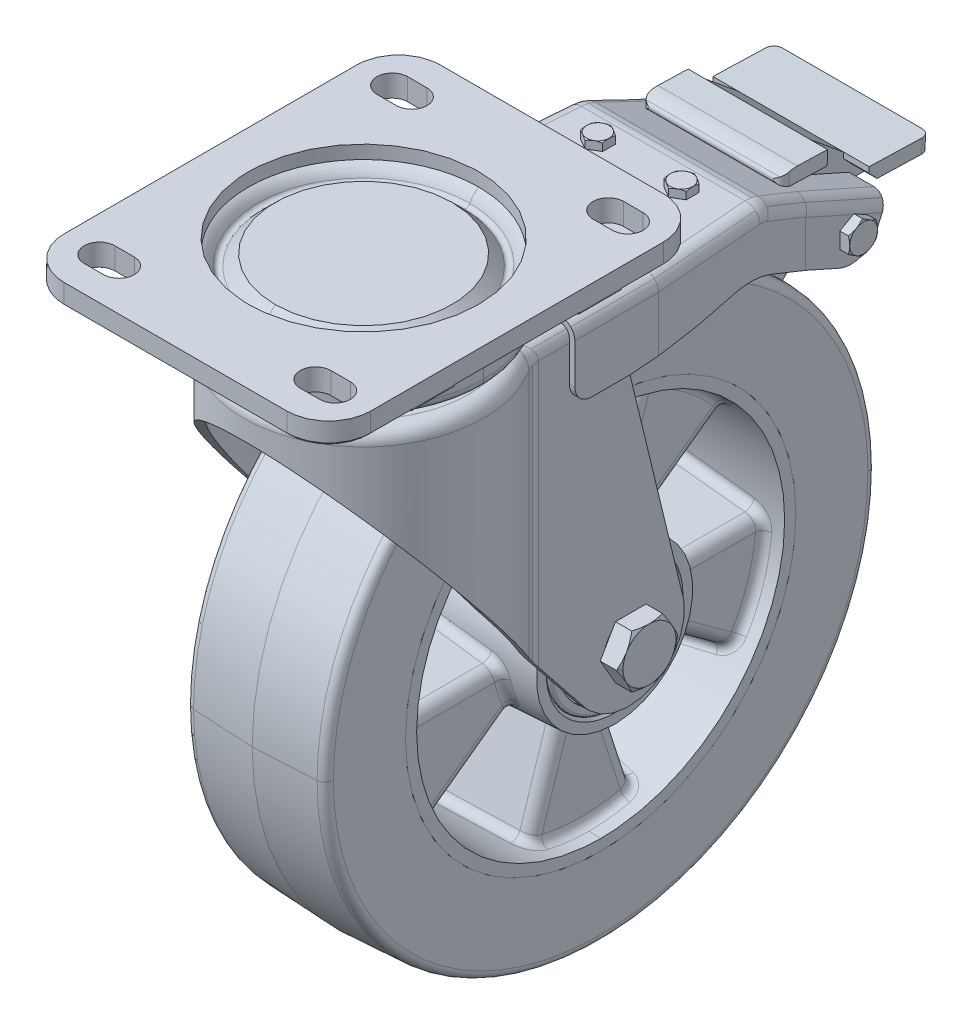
SolidWorks part; units mm, degrees
ref_plane "Front Plane" through (0, 0, 0) normal (0, 0, 1) x (1, 0, 0)
ref_plane "Top Plane" through (0, 0, 0) normal (0, 1, 0) x (1, 0, 0)
ref_plane "Right Plane" through (0, 0, 0) normal (1, 0, 0) x (0, 0, -1)
imported_body "1.5031 Pyörä D200 H238 kääntyvä lukollinen kuulalaakerilla.STEP<1>"
ref_plane "Plane1" through (0, 235.5477, 0) normal (0, 1, 0) x (1, 0, 0)
sketch "Sketch4" plane through (0, 235.5477, 0) normal (0, 1, 0) x (1, 0, 0)
  line L0 (91.5755, -133.1883) -> (11.5755, -133.1883) construction
  line L1 (106.5755, -253.1883) -> (106.5755, -148.1883) construction
  line L2 (11.5755, -268.1883) -> (91.5755, -268.1883) construction
  line L3 (-3.4245, -148.1883) -> (-3.4245, -253.1883) construction
  line L4 (91.5755, -133.1883) -> (11.5755, -133.1883)
  line L5 (106.5755, -253.1883) -> (106.5755, -148.1883)
  line L6 (11.5755, -268.1883) -> (91.5755, -268.1883)
  line L7 (-3.4245, -148.1883) -> (-3.4245, -253.1883)
  arc A0 (0.9689, -137.5817) -> (-3.4245, -148.1883) centre (11.5755, -148.1883) ccw construction
  arc A1 (11.5755, -133.1883) -> (0.9689, -137.5817) centre (11.5755, -148.1883) ccw construction
  arc A2 (102.1821, -137.5817) -> (91.5755, -133.1883) centre (91.5755, -148.1883) ccw construction
  arc A3 (106.5755, -148.1883) -> (102.1821, -137.5817) centre (91.5755, -148.1883) ccw construction
  arc A4 (102.1821, -263.7949) -> (106.5755, -253.1883) centre (91.5755, -253.1883) ccw construction
  arc A5 (91.5755, -268.1883) -> (102.1821, -263.7949) centre (91.5755, -253.1883) ccw construction
  arc A6 (0.9689, -263.7949) -> (11.5755, -268.1883) centre (11.5755, -253.1883) ccw construction
  arc A7 (-3.4245, -253.1883) -> (0.9689, -263.7949) centre (11.5755, -253.1883) ccw construction
  arc A8 (0.9689, -137.5817) -> (-3.4245, -148.1883) centre (11.5755, -148.1883) ccw
  arc A9 (11.5755, -133.1883) -> (0.9689, -137.5817) centre (11.5755, -148.1883) ccw
  arc A10 (102.1821, -137.5817) -> (91.5755, -133.1883) centre (91.5755, -148.1883) ccw
  arc A11 (106.5755, -148.1883) -> (102.1821, -137.5817) centre (91.5755, -148.1883) ccw
  arc A12 (102.1821, -263.7949) -> (106.5755, -253.1883) centre (91.5755, -253.1883) ccw
  arc A13 (91.5755, -268.1883) -> (102.1821, -263.7949) centre (91.5755, -253.1883) ccw
  arc A14 (0.9689, -263.7949) -> (11.5755, -268.1883) centre (11.5755, -253.1883) ccw
  arc A15 (-3.4245, -253.1883) -> (0.9689, -263.7949) centre (11.5755, -253.1883) ccw
extrude "Cut-Extrude1" cut sketch "Sketch4" along normal through all
sketch "Sketch5" plane through (0, 235.5477, 0) normal (0, 1, 0) x (1, 0, 0)
  line L0 (93.8255, -258.6883) -> (86.8255, -258.6883) construction
  line L1 (86.8255, -247.6883) -> (93.8255, -247.6883) construction
  line L2 (16.3255, -258.6883) -> (9.3255, -258.6883) construction
  line L3 (9.3255, -247.6883) -> (16.3255, -247.6883) construction
  line L4 (-3.4245, -148.1883) -> (-3.4245, -253.1883)
  line L6 (-3.4245, -148.1883) -> (-3.4245, -253.1883)
  line L12 (86.8255, -142.6883) -> (93.8255, -142.6883) construction
  line L13 (93.8255, -153.6883) -> (86.8255, -153.6883) construction
  line L14 (9.3255, -142.6883) -> (16.3255, -142.6883) construction
  line L15 (16.3255, -153.6883) -> (9.3255, -153.6883) construction
  line L16 (93.8255, -258.6883) -> (86.8255, -258.6883)
  line L17 (86.8255, -247.6883) -> (93.8255, -247.6883)
  line L18 (16.3255, -258.6883) -> (9.3255, -258.6883)
  line L19 (9.3255, -247.6883) -> (16.3255, -247.6883)
  line L20 (86.8255, -142.6883) -> (93.8255, -142.6883)
  line L21 (93.8255, -153.6883) -> (86.8255, -153.6883)
  line L22 (9.3255, -142.6883) -> (16.3255, -142.6883)
  line L23 (16.3255, -153.6883) -> (9.3255, -153.6883)
  line L28 (11.5755, -268.1883) -> (91.5755, -268.1883)
  line L29 (11.5755, -268.1883) -> (91.5755, -268.1883)
  line L30 (106.5755, -253.1883) -> (106.5755, -148.1883)
  line L31 (106.5755, -253.1883) -> (106.5755, -148.1883)
  line L32 (91.5755, -133.1883) -> (11.5755, -133.1883)
  line L33 (91.5755, -133.1883) -> (11.5755, -133.1883)
  arc A0 (51.5755, -241.9466) -> (51.5755, -159.4299) centre (51.5755, -200.6883) ccw construction
  arc A1 (51.5755, -159.4299) -> (51.5755, -241.9466) centre (51.5755, -200.6883) ccw construction
  arc A2 (51.5755, -241.9466) -> (51.5755, -159.4299) centre (51.5755, -200.6883) ccw
  arc A3 (51.5755, -159.4299) -> (51.5755, -241.9466) centre (51.5755, -200.6883) ccw
  arc A4 (93.8255, -258.6883) -> (93.8255, -247.6883) centre (93.8255, -253.1883) ccw construction
  arc A5 (86.8255, -247.6883) -> (86.8255, -258.6883) centre (86.8255, -253.1883) ccw construction
  arc A6 (16.3255, -258.6883) -> (16.3255, -247.6883) centre (16.3255, -253.1883) ccw construction
  arc A7 (9.3255, -247.6883) -> (9.3255, -258.6883) centre (9.3255, -253.1883) ccw construction
  arc A8 (11.5755, -133.1883) -> (0.9689, -137.5817) centre (11.5755, -148.1883) ccw
  arc A10 (11.5755, -133.1883) -> (0.9689, -137.5817) centre (11.5755, -148.1883) ccw
  arc A24 (93.8255, -153.6883) -> (93.8255, -142.6883) centre (93.8255, -148.1883) ccw construction
  arc A25 (86.8255, -142.6883) -> (86.8255, -153.6883) centre (86.8255, -148.1883) ccw construction
  arc A26 (16.3255, -153.6883) -> (16.3255, -142.6883) centre (16.3255, -148.1883) ccw construction
  arc A27 (9.3255, -142.6883) -> (9.3255, -153.6883) centre (9.3255, -148.1883) ccw construction
  arc A28 (93.8255, -258.6883) -> (93.8255, -247.6883) centre (93.8255, -253.1883) ccw
  arc A29 (86.8255, -247.6883) -> (86.8255, -258.6883) centre (86.8255, -253.1883) ccw
  arc A30 (16.3255, -258.6883) -> (16.3255, -247.6883) centre (16.3255, -253.1883) ccw
  arc A31 (9.3255, -247.6883) -> (9.3255, -258.6883) centre (9.3255, -253.1883) ccw
  arc A32 (93.8255, -153.6883) -> (93.8255, -142.6883) centre (93.8255, -148.1883) ccw
  arc A33 (86.8255, -142.6883) -> (86.8255, -153.6883) centre (86.8255, -148.1883) ccw
  arc A34 (16.3255, -153.6883) -> (16.3255, -142.6883) centre (16.3255, -148.1883) ccw
  arc A35 (9.3255, -142.6883) -> (9.3255, -153.6883) centre (9.3255, -148.1883) ccw
  arc A40 (0.9689, -137.5817) -> (-3.4245, -148.1883) centre (11.5755, -148.1883) ccw
  arc A41 (0.9689, -137.5817) -> (-3.4245, -148.1883) centre (11.5755, -148.1883) ccw
  arc A42 (-3.4245, -253.1883) -> (0.9689, -263.7949) centre (11.5755, -253.1883) ccw
  arc A43 (-3.4245, -253.1883) -> (0.9689, -263.7949) centre (11.5755, -253.1883) ccw
  arc A44 (0.9689, -263.7949) -> (11.5755, -268.1883) centre (11.5755, -253.1883) ccw
  arc A45 (0.9689, -263.7949) -> (11.5755, -268.1883) centre (11.5755, -253.1883) ccw
  arc A46 (91.5755, -268.1883) -> (102.1821, -263.7949) centre (91.5755, -253.1883) ccw
  arc A47 (91.5755, -268.1883) -> (102.1821, -263.7949) centre (91.5755, -253.1883) ccw
  arc A48 (102.1821, -263.7949) -> (106.5755, -253.1883) centre (91.5755, -253.1883) ccw
  arc A49 (102.1821, -263.7949) -> (106.5755, -253.1883) centre (91.5755, -253.1883) ccw
  arc A50 (106.5755, -148.1883) -> (102.1821, -137.5817) centre (91.5755, -148.1883) ccw
  arc A51 (106.5755, -148.1883) -> (102.1821, -137.5817) centre (91.5755, -148.1883) ccw
  arc A52 (102.1821, -137.5817) -> (91.5755, -133.1883) centre (91.5755, -148.1883) ccw
  arc A53 (102.1821, -137.5817) -> (91.5755, -133.1883) centre (91.5755, -148.1883) ccw
  dimension "D1" = 0
extrude "Boss-Extrude3" add sketch "Sketch5" along normal blind 4.8
fillet "Fillet1" radius 1
